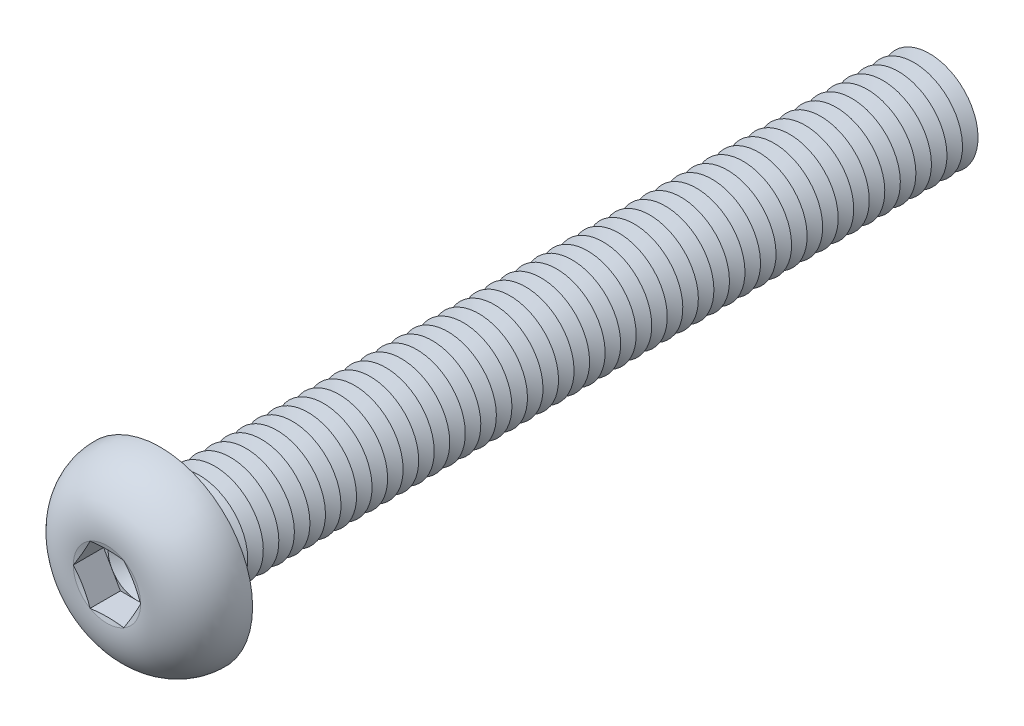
SolidWorks part; units mm, degrees
ref_plane "Front Plane" through (0, 0, 0) normal (0, 0, 1) x (1, 0, 0)
ref_plane "Top Plane" through (0, 0, 0) normal (0, 1, 0) x (1, 0, 0)
ref_plane "Right Plane" through (0, 0, 0) normal (1, 0, 0) x (0, 0, -1)
sketch "Sketch1" plane through (0, 0, 0) normal (1, 0, 0) x (0, 0, -1)
  line L0 (0, 2.5) -> (0, 4.75)
  line L3 (0, 2.5) -> (40, 2.5)
  line L4 (40, 2.5) -> (40, 0)
  line L5 (40, 0) -> (-2.75, 0) construction
  line L6 (-2.75, 0) -> (40, 0)
  line L7 (-2.75, 1.732) -> (-2.75, 0.866) construction
  line L8 (-2.75, 0.866) -> (-2.75, 0)
  line L9 (-2.75, 1.732) -> (-2.5179, 0.866)
  line L10 (-2.5179, 0.866) -> (-2.75, 0.866)
  line L11 (40, 0) -> (22.7481, 0) construction
  line L12 (0, 4.75) -> (-2.75, 4.75) construction
  arc A1 (0, 4.75) -> (-2.75, 1.732) centre (0, 1.9881) ccw
  point P8 (40, 1.25)
  dimension "D1" = 9.5
  dimension "D2" = 5
  dimension "D3" = 2.75
  dimension "D4" = 3.4641
  dimension "D5" = 40
  dimension "D6" = 15
revolve "Revolve1" add sketch "Sketch1" angle 360 about L5
fillet "Fillet1" radius 0.4 1 edges at (0, 2.5, 0)
sketch "Sketch2" plane through (0, 0, 0) normal (1, 0, 0) x (0, 0, -1)
  line L0 (39.6, 2.5) -> (40.4, 2.5)
  line L1 (40, 2.5) -> (0.4, 2.5) construction
  line L2 (40.4, 2.5) -> (40, 1.8072)
  line L3 (40, -2.5) -> (40, 2.5) construction
  line L4 (40, 1.8072) -> (39.6, 2.5)
  dimension "D1" = 0.8
revolve "Cut-Revolve1" cut sketch "Sketch2" angle 360 about axis through (0, 0, -40) along (0, 0, -1)
pattern_linear "LPattern1" count 50 spacing 0.8 along (0, 0, 1) of "Cut-Revolve1"
sketch "Sketch3" plane through (0, 0, 2.75) normal (0, 0, 1) x (1, 0, 0)
  line L7 (0.866, 1.5) -> (-0.866, 1.5)
  line L8 (-0.866, 1.5) -> (-1.7321, 0)
  line L9 (-1.7321, 0) -> (-0.866, -1.5)
  line L10 (-0.866, -1.5) -> (0.866, -1.5)
  line L11 (0.866, -1.5) -> (1.7321, 0)
  line L12 (1.7321, 0) -> (0.866, 1.5)
  circle A0 centre (0, 0) radius 1.5 construction
  circle A3 centre (0, 0) radius 1.732 construction
extrude "Cut-Extrude1" cut sketch "Sketch3" against normal blind 1.56
sketch "Sketch4" plane through (0, 0, 1.19) normal (0, 0, 1) x (1, 0, 0)
  line L1 (0.866, 1.5) -> (-0.866, 1.5) construction
  circle A0 centre (0, 0) radius 1.5
extrude "Cut-Extrude2" cut sketch "Sketch4" against normal through all draft 60
